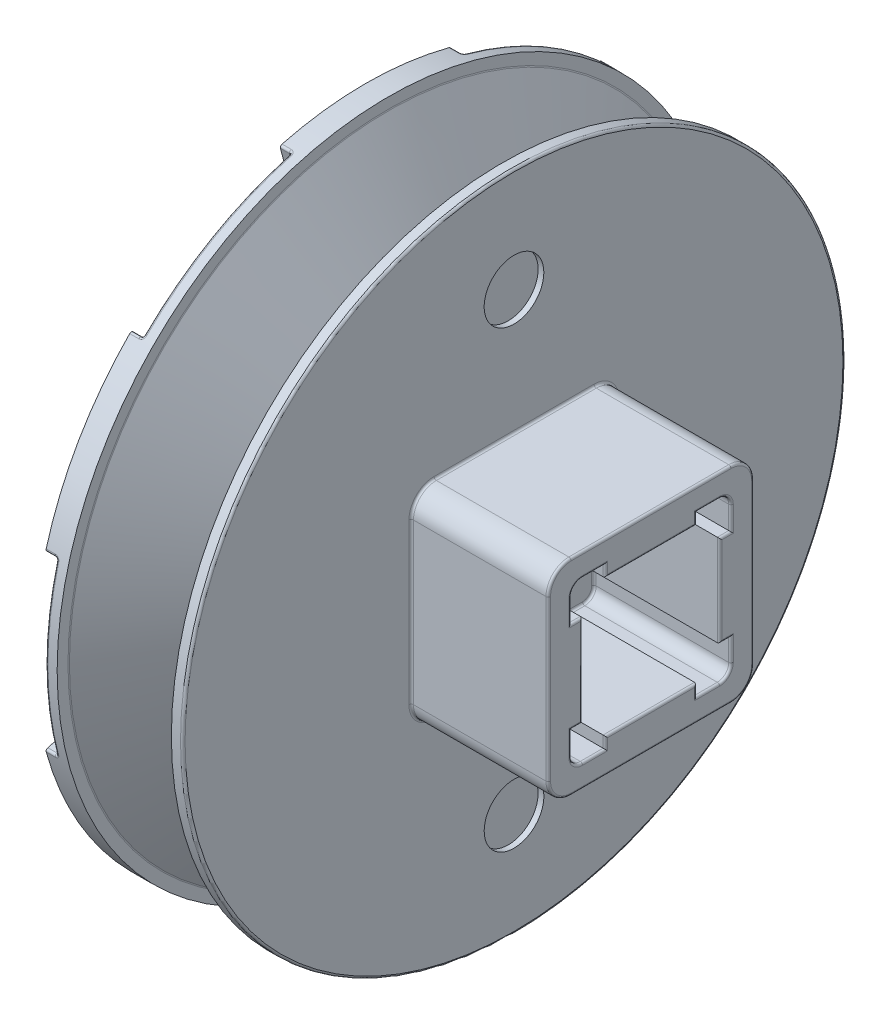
SolidWorks part; units mm, degrees
ref_plane "Face" through (0, 0, 0) normal (0, 0, 1) x (1, 0, 0)
ref_plane "Dessus" through (0, 0, 0) normal (0, 1, 0) x (1, 0, 0)
ref_plane "Droite" through (0, 0, 0) normal (1, 0, 0) x (0, 0, -1)
sketch "Esquisse1" plane through (0, 0, 0) normal (0, 0, 1) x (1, 0, 0)
  line L0 (-34.1614, 0) -> (44.3122, 0) construction
  line L1 (-3, 3.5) -> (-3, 14.5)
  line L2 (-3, 14.5) -> (-2.5, 14.5)
  line L3 (-2.5, 14.5) -> (-2.5, 14)
  line L4 (3, 14.5) -> (3, 0)
  line L5 (-2.5, 14) -> (0, 9.6699)
  line L6 (0, 9.6699) -> (2.5, 14)
  line L7 (2.5, 14) -> (2.5, 14.5)
  line L8 (3, 14.5) -> (2.5, 14.5)
  line L9 (3, 0) -> (-3.25, 0)
  line L10 (-3, 3.5) -> (-3.05, 3.5)
  line L11 (-3.25, 3.3) -> (-3.25, 2.625)
  line L12 (-3.25, 2.375) -> (-3.25, 0)
  arc A0 (-3.25, 2.625) -> (-3.25, 2.375) centre (-3.25, 2.5) ccw
  arc A1 (-3.25, 3.3) -> (-3.05, 3.5) centre (-3.05, 3.3) cw
  point P19 (-3.25, 3.5)
  dimension "D12" = 0.25
  dimension "D14" = 0.2
  dimension "D1" = 3
  dimension "D2" = 6
  dimension "D3" = 0.5
  dimension "D4" = 0.5
  dimension "D5" = 0.5
  dimension "D6" = 0.5
  dimension "D7" = 30
  dimension "D8" = 30
  dimension "D9" = 14.5
  dimension "D10" = 0.25
  dimension "D11" = 7
  dimension "D13" = 1
revolve "Révolution1" add sketch "Esquisse1" angle 360 about L0
sketch "Esquisse2" plane through (3, 0, 0) normal (1, 0, 0) x (0, 0, -1)
  line L0 (-3, 2) -> (-3, -2)
  line L1 (-3.5, 4.5) -> (3.5, 4.5)
  line L2 (-4.5, 3.5) -> (-4.5, -3.5)
  line L3 (-3.5, -4.5) -> (3.5, -4.5)
  line L4 (4.5, 3.5) -> (4.5, -3.5)
  line L5 (-2, -3) -> (2, -3)
  line L6 (2, -3) -> (2, -3.5)
  line L7 (3, -3.5) -> (2, -3.5)
  line L8 (0, 0) -> (-6.965, 0) construction
  line L9 (0, 0) -> (0, -6.9141) construction
  line L10 (3.5, -2) -> (3.5, -3)
  line L11 (-3.5, -2) -> (-3, -2)
  line L12 (-3.5, -2) -> (-3.5, -3)
  line L13 (-3, -3.5) -> (-2, -3.5)
  line L14 (-2, -3) -> (-2, -3.5)
  line L15 (3.5, -2) -> (3, -2)
  line L16 (3, 2) -> (3, -2)
  line L17 (3.5, 2) -> (3, 2)
  line L18 (-2, 3) -> (-2, 3.5)
  line L19 (-3, 3.5) -> (-2, 3.5)
  line L20 (-3.5, 2) -> (-3.5, 3)
  line L21 (-3.5, 2) -> (-3, 2)
  line L22 (3.5, 2) -> (3.5, 3)
  line L23 (3, 3.5) -> (2, 3.5)
  line L24 (2, 3) -> (2, 3.5)
  line L25 (-2, 3) -> (2, 3)
  arc A0 (-4.5, 3.5) -> (-3.5, 4.5) centre (-3.5, 3.5) cw
  arc A1 (4.5, 3.5) -> (3.5, 4.5) centre (3.5, 3.5) ccw
  arc A2 (3.5, -4.5) -> (4.5, -3.5) centre (3.5, -3.5) ccw
  arc A3 (-4.5, -3.5) -> (-3.5, -4.5) centre (-3.5, -3.5) ccw
  arc A4 (-3.5, -3) -> (-3, -3.5) centre (-3, -3) ccw
  arc A5 (3.5, -3) -> (3, -3.5) centre (3, -3) cw
  arc A6 (3.5, 3) -> (3, 3.5) centre (3, 3) ccw
  arc A7 (-3.5, 3) -> (-3, 3.5) centre (-3, 3) cw
  point P6 (-4.5, 4.5)
  point P9 (4.5, 4.5)
  point P14 (-4.5, -4.5)
  point P17 (0, 3)
  point P34 (0, -3)
  point P42 (3, 0)
  point P49 (-3, 0)
  dimension "D5" = 1
  dimension "D9" = 0.5
  dimension "D1" = 4.5
  dimension "D2" = 9
  dimension "D3" = 4.5
  dimension "D4" = 9
  dimension "D7" = 2
  dimension "D8" = 2
  dimension "D6" = 1.5
extrude "Extrusion1" add sketch "Esquisse2" along normal blind 6
sketch "Esquisse4" plane through (-3.25, 0, 0) normal (-1, 0, 0) x (0, 0, 1)
  circle A0 centre (0, 0) radius 1.5
  dimension "D1" = 3
extrude "Enlèv. mat.-Extru.1" cut sketch "Esquisse4" against normal through all
sketch "Esquisse6" plane through (-3, 0, 0) normal (-1, 0, 0) x (0, 0, 1)
  line L0 (0, 0) -> (0, 15.7615) construction
  line L1 (-1.6823, 6.2785) -> (-3.7529, 14.0059)
  line L2 (1.6823, 6.2785) -> (3.7529, 14.0059)
  circle A0 centre (0, 0) radius 14.5 construction
  arc A1 (3.7529, 14.0059) -> (-3.7529, 14.0059) centre (0, 0) ccw
  arc A2 (1.6823, 6.2785) -> (-1.6823, 6.2785) centre (0, 0) ccw
  dimension "D2" = 13
  dimension "D1" = 15
extrude "Extrusion2" add sketch "Esquisse6" along normal blind 0.5
pattern_circular "Répétition circulaire1" count 6 over 360 about axis through (0, 0, 0) along (1, 0, 0) of "Extrusion2"
fillet "Congé1" radius 0.1 107 edges at (-3.25, 14.0059, -3.7529) (-3.25, 10.253, -10.253) (-3.25, 14.0059, 3.7529) (-3.25, 10.253, 10.253) (-3.25, 3.7529, 14.0059) (-3.25, -3.7529, 14.0059) (-3.25, -10.253, 10.253) (-3.25, -14.0059, 3.7529) (-3.25, -14.0059, -3.7529) (-3.25, -10.253, -10.253) (-3.25, -3.7529, -14.0059) (-3.25, 3.7529, -14.0059) (-3, 12.5574, -7.25) (-3, 10.1422, -2.7176) (-3, 6.5, 0) (-3, 10.1422, 2.7176) (-3, 12.5574, 7.25) (-3, 7.4246, 7.4246) (-3, 3.25, 5.6292) (-3, 2.7176, 10.1422) (-3, 0, 14.5) (-3, -2.7176, 10.1422) (-3, -3.25, 5.6292) (-3, -7.4246, 7.4246) (-3, -12.5574, 7.25) (-3, -10.1422, 2.7176) (-3, -6.5, 0) (-3, -10.1422, -2.7176) (-3, -12.5574, -7.25) (-3, -7.4246, -7.4246) (-3, -3.25, -5.6292) (-3, -2.7176, -10.1422) (-3, 0, -14.5) (-3, 2.7176, -10.1422) (-3, 3.25, -5.6292) (-3, 7.4246, -7.4246) (-3, 0, 3.5) (3, 0, 4.5) (3, -4.2071, 4.2071) (3, -4.5, 0) (3, -4.2071, -4.2071) (3, 0, -4.5) (3, 4.2071, -4.2071) (3, 4.5, 0) (3, 4.2071, 4.2071) (3, 0, 14.5) (-2.5, 0, 14) (2.5, 0, 14) (0, 0, 9.6699) (-3.25, 0, 1.5) (3, -2, 3.25) (3, 0, 3) (3, 2, 3.25) (3, 2.5, 3.5) (3, 3.3536, 3.3536) (3, 3.5, 2.5) (3, 3.25, 2) (3, 3, 0) (3, 3.25, -2) (3, 3.5, -2.5) (3, 3.3536, -3.3536) (3, 2.5, -3.5) (3, 2, -3.25) (3, 0, -3) (3, -2, -3.25) (3, -2.5, -3.5) (3, -3.3536, -3.3536) (3, -3.5, -2.5) (3, -3.25, -2) (3, -3, 0) (3, -3.25, 2) (3, -3.5, 2.5) (3, -3.3536, 3.3536) (3, -2.5, 3.5) (3, 0, 1.5) (9, -3.5, 2.5) (9, -3.25, 2) (9, -3, 0) (9, -3.25, -2) (9, -3.5, -2.5) (9, -3.3536, -3.3536) (9, -2.5, -3.5) (9, -2, -3.25) (9, 0, -3) (9, 2, -3.25) (9, 2.5, -3.5) (9, 3.3536, -3.3536) (9, 3.5, -2.5) (9, 3.25, -2) (9, 3, 0) (9, 3.25, 2) (9, 3.5, 2.5) (9, 3.3536, 3.3536) (9, 2.5, 3.5) (9, 2, 3.25) (9, 0, 3) (9, -2, 3.25) (9, -2.5, 3.5) (9, -3.3536, 3.3536) (9, 4.5, 0) (9, 4.2071, -4.2071) (9, 0, -4.5) (9, -4.2071, -4.2071) (9, -4.5, 0) (9, -4.2071, 4.2071) (9, 0, 4.5) (9, 4.2071, 4.2071)
sketch "Esquisse7" plane through (3, 0, 0) normal (1, 0, 0) x (0, 0, -1)
  line L0 (0, 0) -> (0, 15.533) construction
  line L1 (0, 0) -> (19.0366, 0) construction
  circle A0 centre (0, 9.9347) radius 1.3057
  circle A1 centre (0, -9.9347) radius 1.3057
extrude "Enlèv. mat.-Extru.2" cut sketch "Esquisse7" against normal blind 0.25
